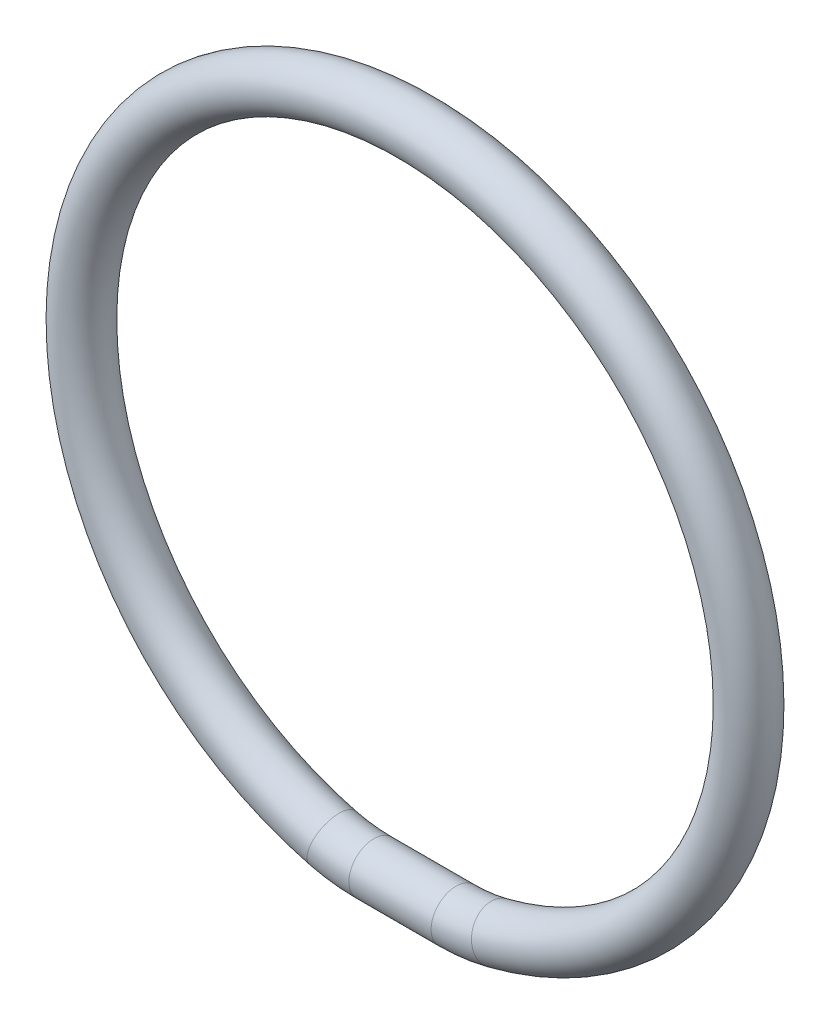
SolidWorks part; units mm, degrees
ref_plane "Plan1" through (0, 0, 0) normal (0, 0, 1) x (1, 0, 0)
ref_plane "Plan2" through (0, 0, 0) normal (0, 1, 0) x (1, 0, 0)
ref_plane "Plan3" through (0, 0, 0) normal (1, 0, 0) x (0, 0, -1)
sketch "Esquisse1" plane through (0, 0, 0) normal (0, 0, 1) x (1, 0, 0)
  line L0 (-2.4652, 0) -> (2.4652, 0)
  arc A0 (-4.9305, 0.3086) -> (4.9305, 0.3086) centre (0, 19.6914) cw
  arc A1 (4.9305, 0.3086) -> (2.4652, 0) centre (2.4652, 10) cw
  arc A2 (-4.9305, 0.3086) -> (-2.4652, 0) centre (-2.4652, 10) ccw
  point P6 (3.5, 0)
  point P9 (-3.5, 0)
  dimension "D1" = 20
  dimension "D3" = 10
  dimension "D2" = 7
sketch "Esquisse2" plane through (0, 0, 0) normal (1, 0, 0) x (0, 0, -1)
  circle A0 centre (0, 0) radius 1.5
  dimension "D1" = 3
sweep "Base-Balayage" add profiles "Esquisse2" path "Esquisse1"
sketch "Esquisse3" plane through (0, 0, 0) normal (1, 0, 0) x (0, 0, -1)
  circle A0 centre (0, 39.6914) radius 1.5
  circle A1 centre (0, 39.6914) radius 1.5 construction
  point P0 (-1.5, 39.6914)
